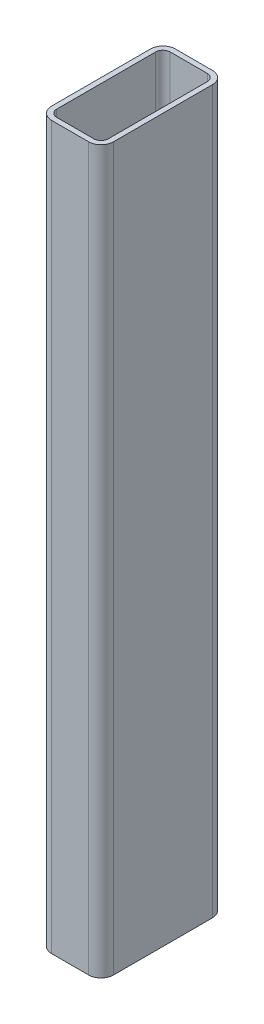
SolidWorks part; units mm, degrees
ref_plane "Vorne" through (0, 0, 0) normal (0, 0, 1) x (1, 0, 0)
ref_plane "Oben" through (0, 0, 0) normal (0, 1, 0) x (1, 0, 0)
ref_plane "Links" through (0, 0, 0) normal (1, 0, 0) x (0, 0, -1)
sketch "Skizze1" plane through (0, 0, 0) normal (0, 0, 1) x (1, 0, 0)
  line L0 (0, 0) -> (0, 700)
  dimension "D1" = 700
ref_plane "Ebene1" through (0, 0, 0) normal (0, 1, 0) x (-1, 0, 0)
other "Strukturbauteil1"
ref_plane "Ebene2" through (0, 0, 0) normal (0, 1, 0) x (-1, 0, 0)
sketch "Sketch1" plane through (0, 0, 0) normal (0, 1, 0) x (-1, 0, 0)
  line L0 (-18, -55) -> (18, -55)
  line L1 (-25, -48) -> (-25, 48)
  line L2 (18, 55) -> (-18, 55)
  line L3 (25, 48) -> (25, -48)
  line L4 (-18, -60) -> (18, -60)
  line L5 (-30, -48) -> (-30, 48)
  line L6 (18, 60) -> (-18, 60)
  line L7 (30, 48) -> (30, -48)
  arc A0 (30, 48) -> (18, 60) centre (18, 48) ccw
  arc A1 (18, -60) -> (30, -48) centre (18, -48) ccw
  arc A2 (-30, -48) -> (-18, -60) centre (-18, -48) ccw
  arc A3 (-18, 60) -> (-30, 48) centre (-18, 48) ccw
  arc A4 (-18, 55) -> (-25, 48) centre (-18, 48) ccw
  arc A5 (25, 48) -> (18, 55) centre (18, 48) ccw
  arc A6 (18, -55) -> (25, -48) centre (18, -48) ccw
  arc A7 (-25, -48) -> (-18, -55) centre (-18, -48) ccw
  point P0 (0, 60)
  point P1 (30, 0)
  point P2 (0, -60)
  point P3 (-30, 0)
  point P4 (-30, 60)
  point P5 (30, 60)
  point P6 (30, -60)
  point P7 (-30, -60)
  point P8 (0, 0)
  point P33 (0, 0)
  dimension "D1" = 12
  dimension "Thickness" = 5
  dimension "V_leg" = 120
  dimension "H_leg" = 60
